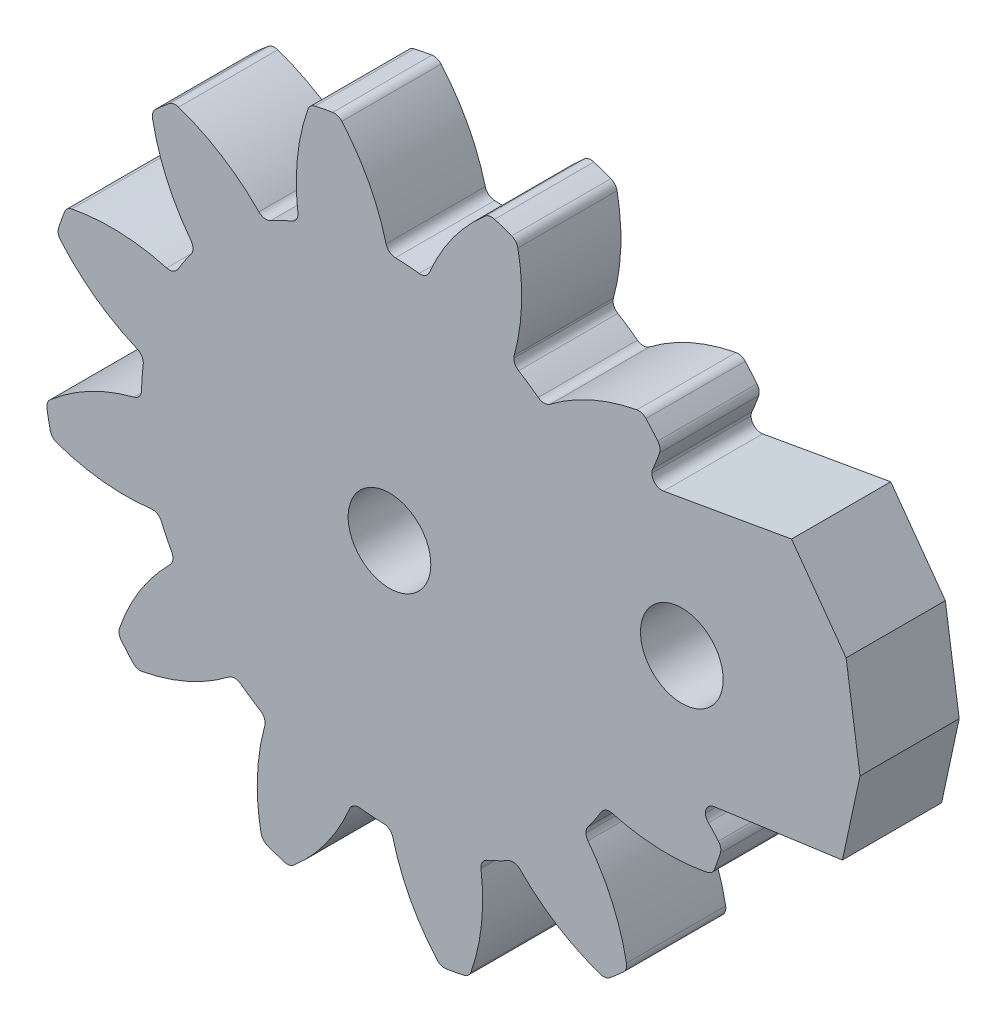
SolidWorks part; units mm, degrees
ref_plane "Front Plane" through (0, 0, 0) normal (0, 0, 1) x (1, 0, 0)
ref_plane "Top Plane" through (0, 0, 0) normal (0, 1, 0) x (1, 0, 0)
ref_plane "Right Plane" through (0, 0, 0) normal (1, 0, 0) x (0, 0, -1)
imported_body "Imported1"
sketch "Sketch3" plane through (0, 0, 3) normal (0, 0, 1) x (1, 0, 0)
  circle A0 centre (101.1588, 41.8935) radius 1.5
extrude "Extrude1" add sketch "Sketch3" against normal blind 3
sketch "Sketch2" plane through (0, 0, 3) normal (0, 0, 1) x (1, 0, 0)
  circle A0 centre (110, 43.3) radius 1.25
  circle A1 centre (101.1588, 41.8935) radius 1.25
extrude "Cut-Extrude1" cut sketch "Sketch2" against normal blind 3
sketch "Sketch4" plane through (0, 0, 3) normal (0, 0, 1) x (1, 0, 0)
  line L2 (114.9684, 45.7277) -> (115.3883, 42.845)
  line L4 (137.3378, 55.5138) -> (137.3378, 30.0863)
  line L5 (104.7067, 59.9504) -> (118.1599, 61.7633)
  line L6 (104.7067, 59.9504) -> (114.9684, 45.7277)
  line L8 (118.1599, 61.7633) -> (137.3378, 55.5138)
  line L9 (121.4993, 24.2662) -> (111.3856, 24.2662)
  line L10 (121.4993, 24.2662) -> (137.3378, 30.0863)
  line L12 (111.3856, 24.2662) -> (115.3883, 42.845)
extrude "Cut-Extrude2" cut sketch "Sketch4" against normal blind 3
scale "Scale1" scale about centroid uniform scaling yes scale factor 1.1
